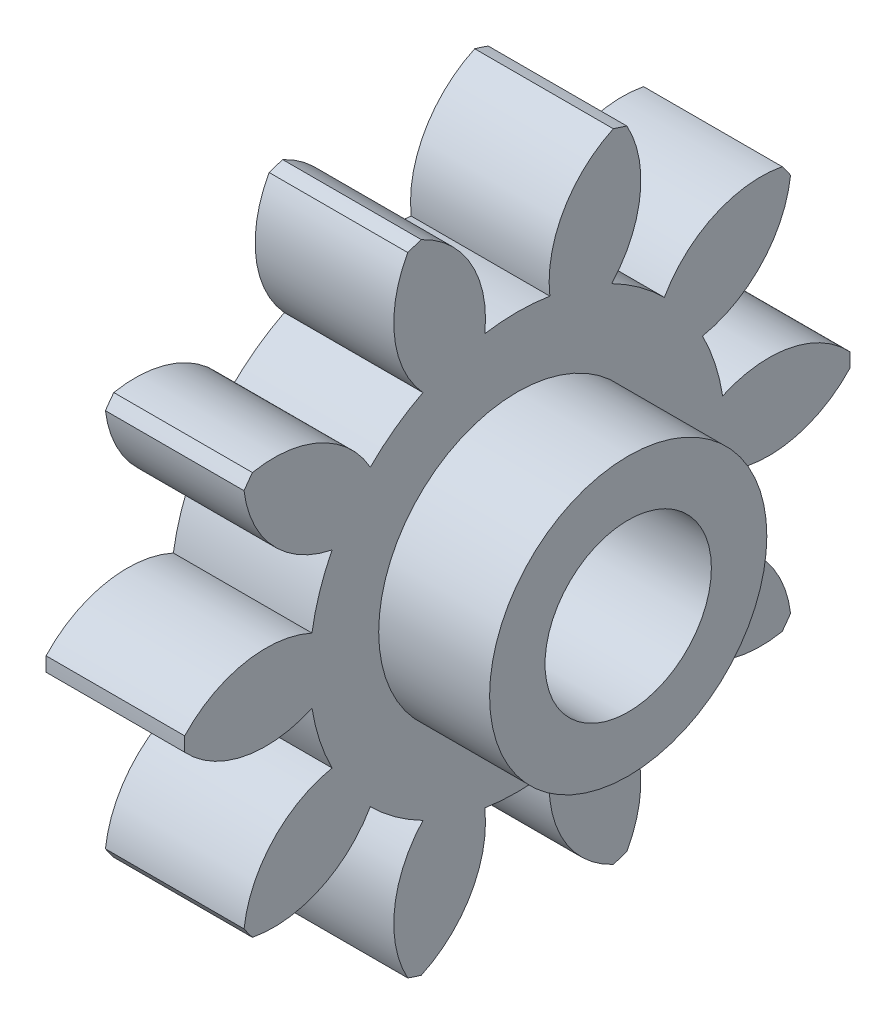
SolidWorks part; units mm, degrees
ref_plane "Plane1" through (0, 0, 0) normal (0, 0, 1) x (1, 0, 0)
ref_plane "Plane2" through (0, 0, 0) normal (0, 1, 0) x (1, 0, 0)
ref_plane "Plane3" through (0, 0, 0) normal (1, 0, 0) x (0, 0, -1)
sketch "HoldingSke" plane through (0, 0, 0) normal (0, 1, 0) x (1, 0, 0)
  line L0 (0, 0) -> (0.4924, -0.0868)
  line L1 (-15, 0) -> (100, 0) construction
  line L2 (0, 0) -> (-2.1039, 2.3779)
  line L3 (0, 0) -> (-11.863, 4.5341)
  line L4 (0, 0) -> (8.5048, 1.4996)
  line L5 (0, 0) -> (-46.8476, -17.4728)
  line L6 (0, 0) -> (-4.1448, -2.7965)
  line L7 (-2.1039, 2.3779) -> (8.6586, 51.2059)
  line L8 (-76.2, 54.61) -> (-75.2, 54.61)
  line L9 (-71.009, 38.7566) -> (-53.1078, 45.2721)
  line L10 (-76.2, 71.12) -> (104.1128, 71.12)
  line L11 (0, 0) -> (-5, 0)
  line L12 (-76.2, 101.6) -> (-76.133, 101.6)
  line L13 (24.9733, 27.94) -> (52.9518, 28.4284)
  line L14 (24.9733, 27.94) -> (24.9743, 27.94)
  line L15 (24.9733, 27.94) -> (100.4006, 29.5858)
  line L16 (-63.627, -2) -> (-12.827, -2)
  circle A0 centre (0, 0) radius 3
  circle A1 centre (0, 0) radius 7.499
  circle A2 centre (0, 0) radius 37.5
  circle A3 centre (0, 0) radius 3
  dimension "MHD" = 14.998
  dimension "Hub_dia" = 75
  dimension "Bore" = 6
  dimension "MBD" = 6
  dimension "Num_teeth" = 10
  dimension "Pitch_radius" = 180.3128
  dimension "Pitch" = 0.5
  dimension "Width" = 5
  dimension "Overall_len" = 50
  dimension "Show_teeth" = 10
  dimension "Thickness" = 5
  dimension "OAL" = 50.0001
  dimension "T_dim" = 1
  dimension "Ap" = 20
  dimension "H" = 19.05
  dimension "Backlash" = 0.067
  dimension "Addendum_fac" = 1
  dimension "Dedendum_fac" = 1.25
  dimension "Clearance_fac" = 0.25
  dimension "Dedendum_add" = 0.001
  dimension "Module" = 2
sketch "BasProSke" plane through (0, 0, 0) normal (0, 1, 0) x (1, 0, 0)
  line L0 (-10, 0) -> (60, 0) construction
  line L1 (0, 0) -> (0, 12)
  line L2 (0, 0) -> (5, 0)
  line L3 (5, 0) -> (5, 12)
  line L4 (5, 12) -> (0, 12)
  dimension "Diameter" = 24
  dimension "Thickness" = 5
revolve "Base-Revolve" add sketch "BasProSke" angle 360 about L0
sketch "TooCutSke" plane through (0, 0, 0) normal (1, 0, 0) x (0, 0, -1)
  line L1 (0, 0) -> (0, 107) construction
  line L2 (0, 0) -> (-1.6814, 9.8576) construction
  line L3 (0, 0) -> (-6.1153, 18.8209) construction
  line L4 (-1.6814, 9.8576) -> (-3.0576, 9.4105) construction
  arc A0 (1.1737, 7.4066) -> (-1.1737, 7.4066) centre (0, 0) ccw
  arc A1 (3.4979, 11.5054) -> (-3.4979, 11.5054) centre (0, 0) ccw
  circle A2 centre (0, 0) radius 10 construction
  circle A3 centre (0, 0) radius 9.3969 construction
  arc A4 (-1.1737, 7.4066) -> (-3.4979, 11.5054) centre (-5.1477, 7.8615) ccw
  arc A5 (3.4979, 11.5054) -> (1.1737, 7.4066) centre (5.1477, 7.8615) ccw
  dimension "Root_dia" = 14.998
  dimension "Overcut_dia" = 24.0508
  dimension "Pitch_dia" = 20
  dimension "Base_dia" = 18.7939
  dimension "Flank_rad" = 4
  dimension "Half_ang" = 18
  dimension "Half_CT" = 1.4471
extrude "ToothCut" cut sketch "TooCutSke" along normal through all
fillet "Breaks" [suppressed] radius 0.04
fillet "RootFillets" [suppressed] radius 0.501
pattern_circular "TeethCuts" count 10 every 36 about axis through (-10, 0, 0) along (1, 0, 0) of "ToothCut", "RootFillets", "Breaks"
sketch "HubNeaOneSke" plane through (0, 0, 0) normal (-1, 0, 0) x (0, 0, 1)
  circle A0 centre (0, 0) radius 7.499
  dimension "Diameter" = 14.998
extrude "HubNearOne" [suppressed] add sketch "HubNeaOneSke" along normal blind 45.0001
sketch "HubNeaBotSke" plane through (0, 0, 0) normal (-1, 0, 0) x (0, 0, 1)
  circle A0 centre (0, 0) radius 7.499
  dimension "Diameter" = 14.998
extrude "HubNearBoth" [suppressed] add sketch "HubNeaBotSke" along normal blind 22.5
ref_plane "FarPln" through (5, 0, 0) normal (1, 0, 0) x (0, 0, -1)
sketch "HubFarSke" plane through (5, 0, 0) normal (1, 0, 0) x (0, 0, -1)
  circle A0 centre (0, 0) radius 7.499
  dimension "Diameter" = 14.998
extrude "HubFar" [suppressed] add sketch "HubFarSke" along normal blind 22.5
sketch "BorSke" plane through (0, 0, 0) normal (1, 0, 0) x (0, 0, -1)
  circle A0 centre (0, 0) radius 3
  dimension "Diameter" = 6
extrude "Bore" cut sketch "BorSke" along normal mid plane 100.0001
sketch "KeySke" plane through (0, 0, 0) normal (1, 0, 0) x (0, 0, -1)
  line L0 (-1, 0) -> (-1, 4)
  line L1 (-1, 4) -> (1, 4)
  line L2 (1, 4) -> (1, 0)
  line L3 (0, 0) -> (0, 34) construction
  line L4 (-1, 0) -> (1, 0)
  dimension "Offset" = 4
  dimension "Width" = 2
extrude "Keyway" [suppressed] cut sketch "KeySke" along normal mid plane 100.0001
pattern_circular "Keyway2" [suppressed] count 2 every 90 about axis through (-10, 0, 0) along (1, 0, 0)
sketch "Sketch1" plane through (5, 0, 0) normal (1, 0, 0) x (0, 0, -1)
  circle A0 centre (0, 0) radius 3
  circle A1 centre (0, 0) radius 5
  dimension "D1" = 10
  dimension "D2" = 6
extrude "Boss-Extrude1" add sketch "Sketch1" along normal blind 4
equation "' \"Module@HoldingSke\" = 6.35"
equation "' \"Num_teeth@HoldingSke\" = 12"
equation "' \"Ap@HoldingSke\" =  20"
equation "' \"Width@HoldingSke\" = 0.5 * 25.4"
equation "' \"Hub_dia@HoldingSke\"= 1 * 25.4"
equation "' \"Overall_len@HoldingSke\" = 1.0 * 25.4"
equation "' \"Bore@HoldingSke\" = 0.75 * 25.4"
equation "' \"T_dim@HoldingSke\" = 0.1 * 25.4"
equation "' \"Width@KeySke\" = 0.25 * 25.4"
equation "' \"Show_teeth@HoldingSke\" = 13"
equation "' \"Backlash@HoldingSke\" = 0.009 * 25.4"
equation "' \"Addendum_fac@HoldingSke\" = 1.0"
equation "' \"Dedendum_fac@HoldingSke\" = 1.25"
equation "' \"Dedendum_add@HoldingSke\" = 0.00005 * 25.4"
equation "' \"Clearance_fac@HoldingSke\" = 0.25"
equation "\"Pitch@HoldingSke\" = 1 / \"Module@HoldingSke\""
equation "\"Overcut_dia@TooCutSke\" = (\"Num_teeth@HoldingSke\" + 2 * \"Addendum_fac@HoldingSke\") / \"Pitch@HoldingSke\" + 0.002 * 25.4"
equation "\"Pitch_dia@TooCutSke\" = \"Num_teeth@HoldingSke\" / \"Pitch@HoldingSke\""
equation "\"Base_dia@TooCutSke\" = \"Num_teeth@HoldingSke\" / \"Pitch@HoldingSke\" * cos((\"Ap@HoldingSke\"  * 3.14159265 / 180))"
equation "\"Root_dia@TooCutSke\" = (\"Num_teeth@HoldingSke\" + 2) / \"Pitch@HoldingSke\" - 2 * (\"Addendum_fac@HoldingSke\" + \"Dedendum_fac@HoldingSke\") / \"Pitch@HoldingSke\" - \"Dedendum_add@HoldingSke\" * 2"
equation "\"Half_ang@TooCutSke\" = 180 / \"Num_teeth@HoldingSke\""
equation "\"Half_CT@TooCutSke\" = \"Num_teeth@HoldingSke\" / \"Pitch@HoldingSke\" * sin((3.14159265 / 2 / \"Num_teeth@HoldingSke\")) / 2 - 7 * \"Backlash@HoldingSke\" / 4"
equation "\"Flank_rad@TooCutSke\" = \"Num_teeth@HoldingSke\" / \"Pitch@HoldingSke\" / 5"
equation "\"Radius@RootFillets\" = \"Clearance_fac@HoldingSke\" / \"Pitch@HoldingSke\" + \"Dedendum_add@HoldingSke\""
equation "\"Break_rad@Breaks\" = 0.02 / \"Pitch@HoldingSke\""
equation "\"Thickness@HoldingSke\" = \"Width@HoldingSke\""
equation "\"OAL@HoldingSke\" = \"Thickness@HoldingSke\""
equation "\"MHD@HoldingSke\" = (\"Num_teeth@HoldingSke\" + 2) / \"Pitch@HoldingSke\" - 2 * (\"Addendum_fac@HoldingSke\" + \"Dedendum_fac@HoldingSke\")  / \"Pitch@HoldingSke\" - \"Dedendum_add@HoldingSke\" * 2"
equation "\"MBD@HoldingSke\" = (\"Num_teeth@HoldingSke\" + 2) / \"Pitch@HoldingSke\" - 2 * (\"Addendum_fac@HoldingSke\" + \"Dedendum_fac@HoldingSke\")  / \"Pitch@HoldingSke\" - \"Dedendum_add@HoldingSke\" * 2 - 0.002 * 25.4"
equation "\"MHD@HoldingSke\" = ((sgn( \"MHD@HoldingSke\" - \"Hub_dia@HoldingSke\" )-1)*( \"MHD@HoldingSke\" - \"Hub_dia@HoldingSke\" ))/-2+ \"Hub_dia@HoldingSke\""
equation "\"MBD@HoldingSke\" = ((sgn( \"MBD@HoldingSke\" - \"Bore@HoldingSke\" )-1)*( \"MBD@HoldingSke\" - \"Bore@HoldingSke\" ))/-2+ \"Bore@HoldingSke\""
equation "\"OAL@HoldingSke\" = ((sgn( \"OAL@HoldingSke\" - \"Overall_len@HoldingSke\" )+1)*( \"OAL@HoldingSke\" - \"Overall_len@HoldingSke\" ))/2 + \"Overall_len@HoldingSke\" + 0.000002 * 25.4"
equation "\"Num_teeth@TeethCuts\" = int( \"Show_teeth@HoldingSke\" ) + 1"
equation "\"Num_teeth@TeethCuts\" = ((sgn( \"Num_teeth@TeethCuts\" - \"Num_teeth@HoldingSke\" )-1)*( \"Num_teeth@TeethCuts\" - \"Num_teeth@HoldingSke\" ))/-2+ \"Num_teeth@HoldingSke\""
equation "\"Num_teeth@TeethCuts\" = ((sgn( \"Num_teeth@TeethCuts\" - 2.0)+1)*( \"Num_teeth@TeethCuts\" - 2.0))/2 +2.0"
equation "\"Angle@TeethCuts\" = 360.0 / \"Num_teeth@HoldingSke\""
equation "\"Diameter@BasProSke\" = (\"Num_teeth@HoldingSke\" + 2 * \"Addendum_fac@HoldingSke\") / \"Pitch@HoldingSke\""
equation "\"Thickness@BasProSke\"  = \"Thickness@HoldingSke\""
equation "' \"Fillet_rad@BasProSke\" =  \"Thickness@HoldingSke\" * 0.05"
equation "\"MHD@HoldingSke\" = ((sgn( \"MHD@HoldingSke\" - \"Root_dia@TooCutSke\" )-1)*( \"MHD@HoldingSke\" - \"Root_dia@TooCutSke\" ))/-2+ \"Root_dia@TooCutSke\""
equation "\"Diameter@HubNeaOneSke\" = \"MHD@HoldingSke\""
equation "\"Length@HubNearOne\" = \"OAL@HoldingSke\" - \"Thickness@BasProSke\""
equation "\"Diameter@HubNeaBotSke\" = \"MHD@HoldingSke\""
equation "\"Length@HubNearBoth\" = ( \"OAL@HoldingSke\" - \"Thickness@BasProSke\" ) / 2.0"
equation "\"Thickness@FarPln\" = \"Thickness@BasProSke\""
equation "\"Diameter@HubFarSke\" = \"MHD@HoldingSke\""
equation "\"Length@HubFar\" = ( \"OAL@HoldingSke\" - \"Thickness@BasProSke\" ) / 2.0"
equation "\"Diameter@BorSke\" = \"MBD@HoldingSke\""
equation "\"D1@Bore\" = \"OAL@HoldingSke\" * 2.0"
equation "\"D1@Keyway\" = \"OAL@HoldingSke\" * 2.0"
equation "\"Offset@KeySke\" = \"T_dim@HoldingSke\" + \"MBD@HoldingSke\" / 2.0"
